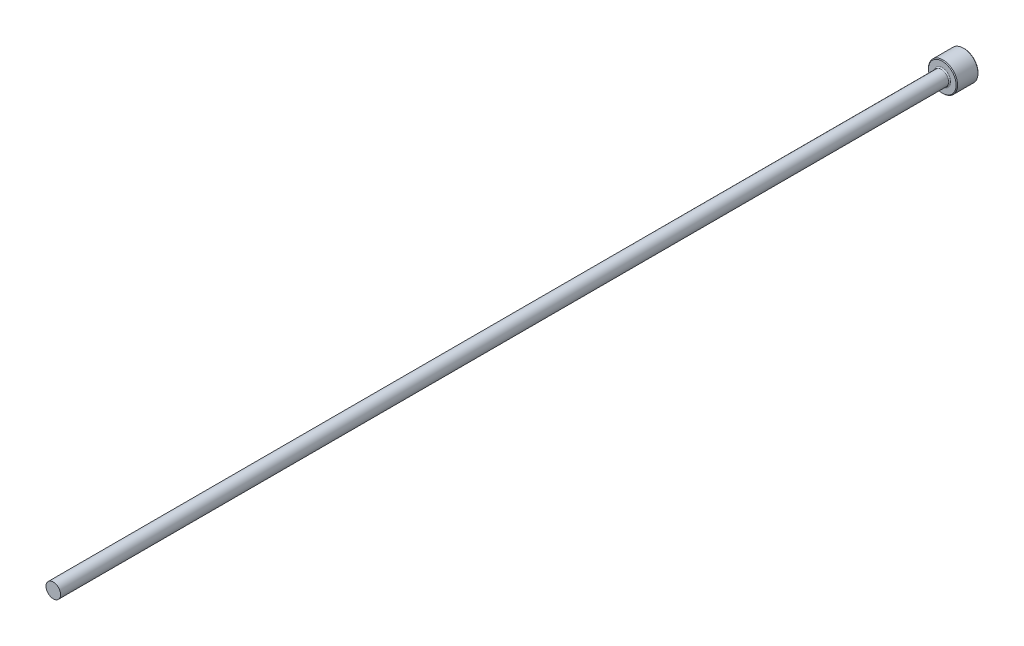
SolidWorks part; units mm, degrees
ref_plane "Front Plane" through (0, 0, 0) normal (0, 0, 1) x (1, 0, 0)
ref_plane "Top Plane" through (0, 0, 0) normal (0, 1, 0) x (1, 0, 0)
ref_plane "Right Plane" through (0, 0, 0) normal (1, 0, 0) x (0, 0, -1)
sketch "Sketch1" plane through (0, 0, 0) normal (1, 0, 0) x (0, 0, -1)
  line L0 (0, 0) -> (0, 4)
  line L1 (0, 4.4) -> (0, -4.4) construction
  line L2 (0, 4) -> (-6, 4)
  line L3 (-6, 4) -> (-6, 2.3)
  line L4 (-6.3, 2) -> (-250, 2)
  line L5 (-250, 2) -> (-250, 0)
  line L6 (4.4, 0) -> (-4.4, 0) construction
  line L7 (-250, 0) -> (0, 0)
  line L8 (-109.0506, 0) -> (16.9928, 0) construction
  arc A0 (-6, 2.3) -> (-6.3, 2) centre (-6.3, 2.3) cw
  dimension "D1" = 0.3
  dimension "D2" = 8
  dimension "D3" = 4
  dimension "D4" = 250
  dimension "D5" = 6
revolve "Revolve1" add sketch "Sketch1" angle 360 about L8
chamfer "Chamfer1" distance 0.2 angle 45 2 edges at (4, 0, 0) (4, 0, 6)
